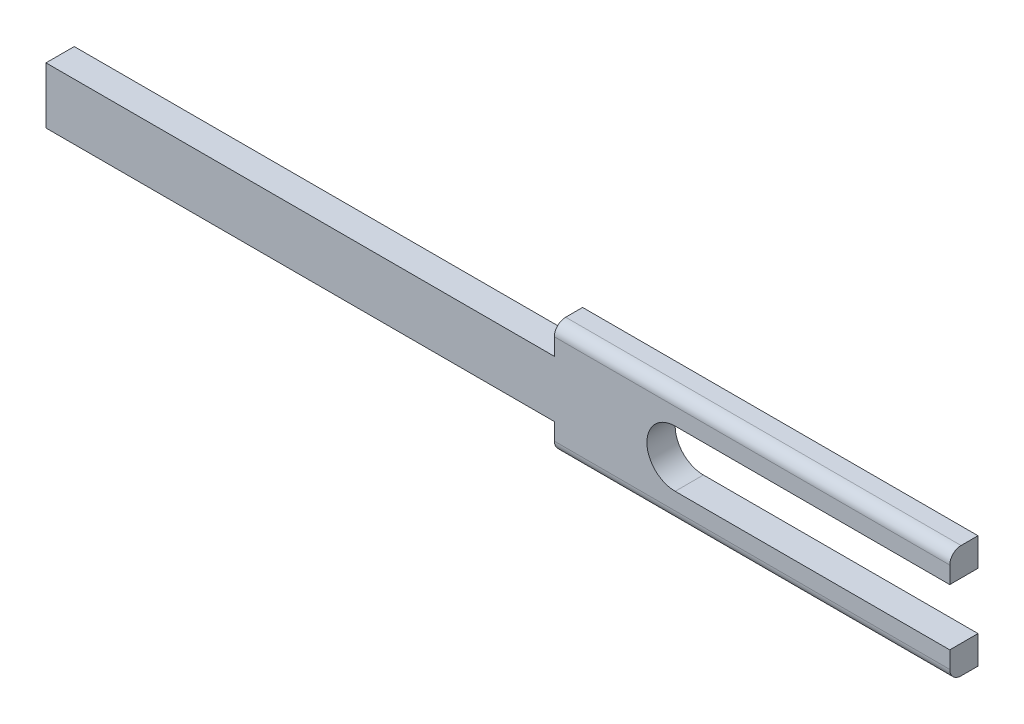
SolidWorks part; units mm, degrees
ref_plane "Front Plane" through (0, 0, 0) normal (0, 0, 1) x (1, 0, 0)
ref_plane "Top Plane" through (0, 0, 0) normal (0, 1, 0) x (1, 0, 0)
ref_plane "Right Plane" through (0, 0, 0) normal (1, 0, 0) x (0, 0, -1)
sketch "Sketch1" plane through (0, 0, 0) normal (0, 0, 1) x (1, 0, 0)
  line L0 (-2.9252, 8.7114) -> (-2.9252, -48.8962) construction
  line L1 (-60.0752, -2.8616) -> (41.5248, -2.8616)
  line L2 (-60.0752, -2.8616) -> (-60.0752, -28.2616)
  line L3 (-60.0752, -28.2616) -> (41.5248, -28.2616)
  line L4 (41.5248, -2.8616) -> (41.5248, -28.2616)
  line L5 (-66.3683, -15.5616) -> (49.8732, -15.5616) construction
  line L8 (-60.0752, -10.3445) -> (-60.0752, -15.5616)
  dimension "D1" = 101.6
  dimension "D2" = 25.4
  dimension "D3" = 57.15
  dimension "D4" = 12.7
extrude "Extrude1" add sketch "Sketch1" along normal blind 3.175 contours L3 L4 L1 L2
sketch "Sketch2" plane through (0, 0, 3.175) normal (0, 0, 1) x (1, 0, 0)
  line L0 (-2.9252, -9.2116) -> (-2.9252, -49.7767) construction
  line L1 (-60.0752, -28.2616) -> (-60.0752, -2.8616) construction
  line L2 (-2.9252, -12.3866) -> (-2.9252, -9.2116)
  line L3 (-2.9252, -12.3866) -> (-60.0752, -12.3866)
  line L4 (-2.9252, -9.2116) -> (43.3286, -9.2116)
  line L5 (43.3286, -9.2116) -> (43.3286, -12.3866)
  line L6 (43.3286, -12.3866) -> (10.653, -12.3866)
  line L7 (43.3286, -18.7366) -> (10.653, -18.7366)
  line L8 (-68.0563, -15.5616) -> (47.5415, -15.5616) construction
  line L9 (41.5248, -2.8616) -> (-60.0752, -2.8616) construction
  line L10 (43.3286, -21.9116) -> (43.3286, -18.7366)
  line L11 (-2.9252, -21.9116) -> (43.3286, -21.9116)
  line L12 (-2.9252, -18.7366) -> (-2.9252, -21.9116)
  line L13 (-2.9252, -18.7366) -> (-60.0752, -18.7366)
  line L14 (-60.0752, -18.7366) -> (-60.0752, -12.3866)
  arc A0 (10.653, -18.7366) -> (10.653, -12.3866) centre (10.653, -15.5616) cw
  dimension "D1" = 57.15
  dimension "D2" = 12.7
  dimension "D3" = 3.175
extrude "Cut-Extrude1" cut sketch "Sketch2" against normal blind 3.81 flip side to cut
fillet "Fillet1" radius 1.27 1 edges at (19.2998, -21.9116, 3.175)
fillet "Fillet2" radius 1.27 1 edges at (19.2998, -9.2116, 3.175)
